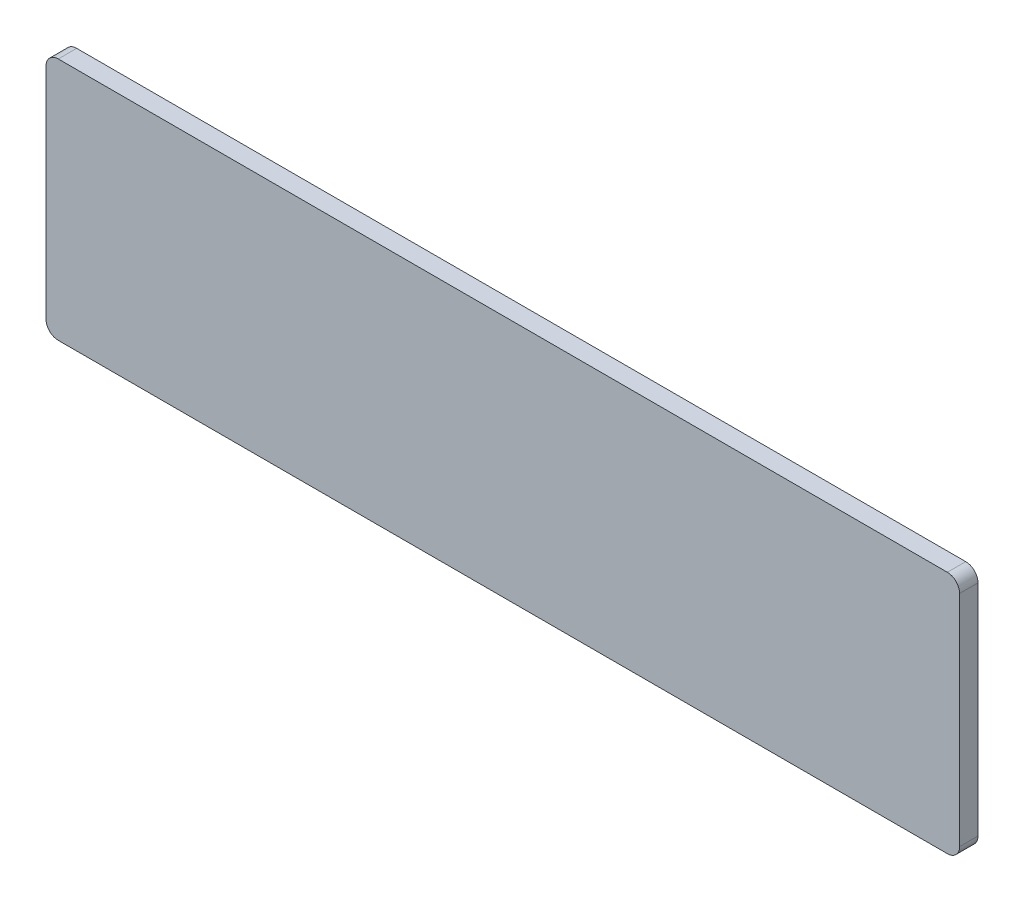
SolidWorks part; units mm, degrees
ref_plane "Front Plane" through (0, 0, 0) normal (0, 0, 1) x (1, 0, 0)
ref_plane "Top Plane" through (0, 0, 0) normal (0, 1, 0) x (1, 0, 0)
ref_plane "Right Plane" through (0, 0, 0) normal (1, 0, 0) x (0, 0, -1)
sketch "Sketch1" plane through (0, 0, 0) normal (0, 0, 1) x (1, 0, 0)
  line L1 (74.5, -19.875) -> (-74.5, -19.875)
  line L2 (74.5, -19.875) -> (74.5, 19.875)
  line L3 (74.5, 19.875) -> (-74.5, 19.875)
  line L4 (-74.5, -19.875) -> (-74.5, 19.875)
  line L5 (74.5, -19.875) -> (-74.5, 19.875) construction
  line L6 (74.5, 19.875) -> (-74.5, -19.875) construction
  point P0 (0, 0)
  dimension "D1" = 149
  dimension "D2" = 39.75
extrude "Boss-Extrude1" add sketch "Sketch1" along normal blind 3
fillet "Fillet1" radius 2 4 edges at (-74.5, -19.875, 1.5) (-74.5, 19.875, 1.5) (74.5, -19.875, 1.5) (74.5, 19.875, 1.5)
